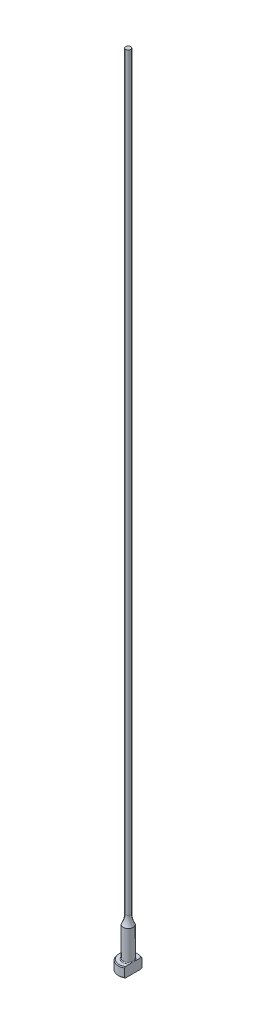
SolidWorks part; units mm, degrees
ref_plane "Front Plane" through (0, 0, 0) normal (0, 0, 1) x (1, 0, 0)
ref_plane "Top Plane" through (0, 0, 0) normal (0, 1, 0) x (1, 0, 0)
ref_plane "Right Plane" through (0, 0, 0) normal (1, 0, 0) x (0, 0, -1)
sketch "Sketch1" plane through (0, 0, 0) normal (0, 0, 1) x (1, 0, 0)
  line L0 (0, 259.9588) -> (0, -15.1925) construction
  line L1 (0, 0) -> (-3.175, 0)
  line L2 (-3.175, 0) -> (-3.175, 3.175)
  line L3 (-3.175, 3.175) -> (-1.5875, 3.175)
  line L4 (-0.7937, 15.7742) -> (-0.7937, 254)
  line L5 (-0.7937, 254) -> (0, 254)
  line L6 (0, 254) -> (0, 0)
  line L7 (-1.5875, 3.175) -> (-1.5875, 12.7)
  arc A0 (-1.5875, 12.7) -> (-0.7937, 15.7742) centre (-7.1437, 15.7742) ccw
  point P13 (-1.5875, 0)
  dimension "D1" = 6.35
  dimension "L" = 254
  dimension "D2" = 3.175
  dimension "H" = 6.35
  dimension "T" = 3.175
  dimension "D" = 1.5875
  dimension "S" = 12.7
revolve "Revolve1" add sketch "Sketch1" angle 360 about L0
chamfer "Chamfer1" distance 0.254 angle 45 2 edges at (0, 3.175, 3.175) (0, 0, 3.175)
fillet "Fillet1" radius 0.254 1 edges at (0, 3.175, 1.5875)
sketch "Sketch2" plane through (0, 0, 0) normal (0, 1, 0) x (1, 0, 0)
  line L0 (1.5875, -2.7496) -> (1.5875, 2.7496)
  circle A0 centre (0, 0) radius 3.175 construction
  arc A2 (1.5875, -2.7496) -> (1.5875, 2.7496) centre (0, 0) ccw
  circle A3 centre (0, 0) radius 3.175 construction
  circle A4 centre (0, 0) radius 1.5875 construction
extrude "Key Head" cut sketch "Sketch2" along normal up to next
